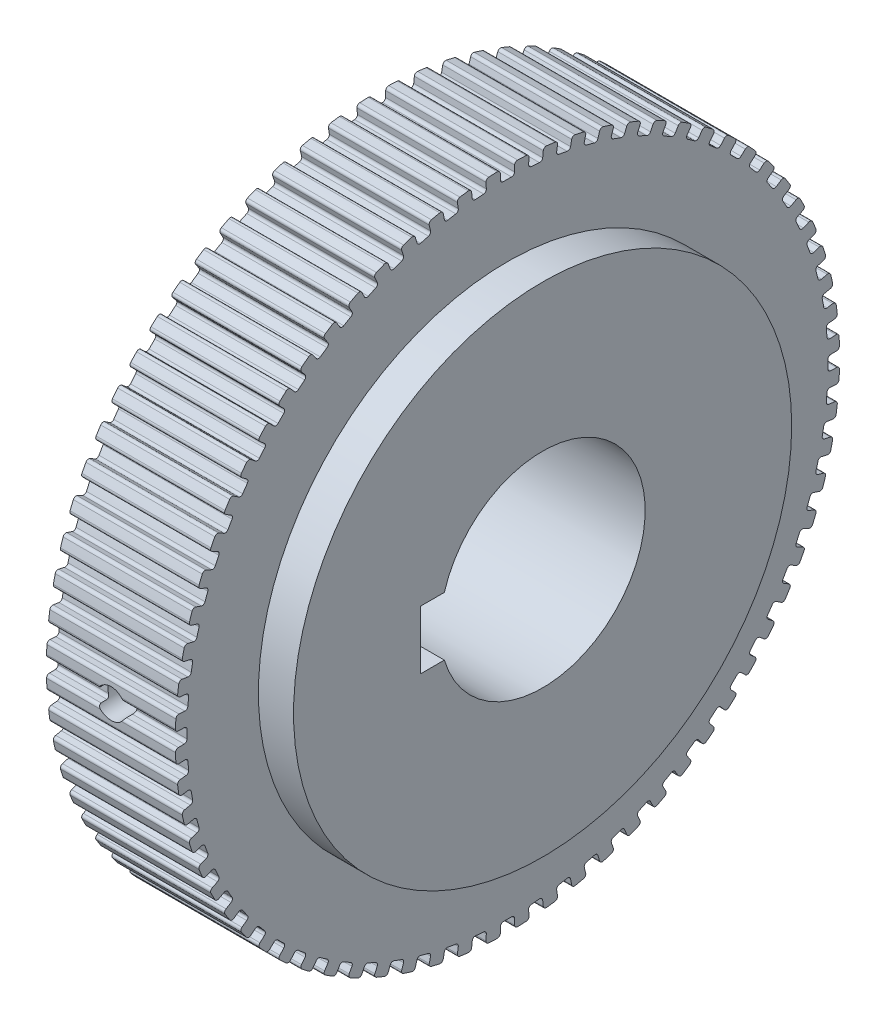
SolidWorks part; units mm, degrees
ref_plane "Спереди" through (0, 0, 0) normal (0, 0, 1) x (1, 0, 0)
ref_plane "Сверху" through (0, 0, 0) normal (0, 1, 0) x (1, 0, 0)
ref_plane "Справа" through (0, 0, 0) normal (1, 0, 0) x (0, 0, -1)
sketch "Эскиз1" plane through (0, 0, 0) normal (0, 0, 1) x (1, 0, 0)
  line L0 (-28, 56.675) -> (-28, 0)
  line L1 (-28, 0) -> (-6, 0)
  line L2 (-6, 0) -> (-6, 56.675)
  line L3 (-6, 56.675) -> (-28, 56.675)
  line L4 (-28, 0) -> (-6, 0) construction
revolve "Повернуть1" add sketch "Эскиз1" angle 360 about L4
sketch "Эскиз2" plane through (-6, 0, 0) normal (1, 0, 0) x (0, 0, -1)
  line L0 (56.0154, -8.6216) -> (54.0387, -8.3173)
  line L1 (53.6244, -10.6666) -> (55.586, -11.0567)
  arc A0 (54.0387, -8.3173) -> (53.6244, -10.6666) centre (0, 0) cw
  arc A1 (55.586, -11.0567) -> (56.0154, -8.6216) centre (0, 0) ccw
extrude "Вырез-Вытянуть1" cut sketch "Эскиз2" against normal through all
sketch "Эскиз3" plane through (-6, 0, 0) normal (1, 0, 0) x (0, 0, -1)
  line L0 (55.0508, -13.4708) -> (53.1081, -12.9955)
  line L1 (52.4907, -15.2997) -> (54.4108, -15.8593)
  arc A0 (53.1081, -12.9955) -> (52.4907, -15.2997) centre (0, 0) cw
  arc A1 (54.4108, -15.8593) -> (55.0508, -13.4708) centre (0, 0) ccw
extrude "Вырез-Вытянуть2" cut sketch "Эскиз3" against normal through all
sketch "Эскиз4" plane through (-6, 0, 0) normal (1, 0, 0) x (0, 0, -1)
  line L0 (53.6673, -18.2176) -> (51.7734, -17.5747)
  line L1 (50.9575, -19.8163) -> (52.8215, -20.5412)
  arc A0 (51.7734, -17.5747) -> (50.9575, -19.8163) centre (0, 0) cw
  arc A1 (52.8215, -20.5412) -> (53.6673, -18.2176) centre (0, 0) ccw
extrude "Вырез-Вытянуть3" cut sketch "Эскиз4" against normal through all
sketch "Эскиз5" plane through (-6, 0, 0) normal (1, 0, 0) x (0, 0, -1)
  line L0 (51.8753, -22.8257) -> (50.0447, -22.0202)
  line L1 (49.0365, -24.1821) -> (50.8303, -25.0667)
  arc A0 (50.0447, -22.0202) -> (49.0365, -24.1821) centre (0, 0) cw
  arc A1 (50.8303, -25.0667) -> (51.8753, -22.8257) centre (0, 0) ccw
extrude "Вырез-Вытянуть4" cut sketch "Эскиз5" against normal through all
sketch "Эскиз6" plane through (-6, 0, 0) normal (1, 0, 0) x (0, 0, -1)
  line L0 (49.6885, -27.26) -> (47.935, -26.2981)
  line L1 (46.7423, -28.3639) -> (48.4521, -29.4015)
  arc A0 (47.935, -26.2981) -> (46.7423, -28.3639) centre (0, 0) cw
  arc A1 (48.4521, -29.4015) -> (49.6885, -27.26) centre (0, 0) ccw
extrude "Вырез-Вытянуть5" cut sketch "Эскиз6" against normal through all
sketch "Эскиз7" plane through (-6, 0, 0) normal (1, 0, 0) x (0, 0, -1)
  line L0 (47.1235, -31.4869) -> (45.4606, -30.3758)
  line L1 (44.0924, -32.3299) -> (45.7052, -33.5125)
  arc A0 (45.4606, -30.3758) -> (44.0924, -32.3299) centre (0, 0) cw
  arc A1 (45.7052, -33.5125) -> (47.1235, -31.4869) centre (0, 0) ccw
extrude "Вырез-Вытянуть6" cut sketch "Эскиз7" against normal through all
sketch "Эскиз8" plane through (-6, 0, 0) normal (1, 0, 0) x (0, 0, -1)
  line L0 (44.2, -35.4742) -> (42.6402, -34.2224)
  line L1 (41.1068, -36.0497) -> (42.6105, -37.3684)
  arc A0 (42.6402, -34.2224) -> (41.1068, -36.0497) centre (0, 0) cw
  arc A1 (42.6105, -37.3684) -> (44.2, -35.4742) centre (0, 0) ccw
extrude "Вырез-Вытянуть7" cut sketch "Эскиз8" against normal through all
sketch "Эскиз9" plane through (-6, 0, 0) normal (1, 0, 0) x (0, 0, -1)
  line L0 (40.94, -39.1915) -> (39.4952, -37.8085)
  line L1 (37.8085, -39.4952) -> (39.1915, -40.94)
  arc A0 (39.4952, -37.8085) -> (37.8085, -39.4952) centre (0, 0) cw
  arc A1 (39.1915, -40.94) -> (40.94, -39.1915) centre (0, 0) ccw
extrude "Вырез-Вытянуть8" cut sketch "Эскиз9" against normal through all
sketch "Эскиз10" plane through (-6, 0, 0) normal (1, 0, 0) x (0, 0, -1)
  line L0 (37.3684, -42.6105) -> (36.0497, -41.1068)
  line L1 (34.2224, -42.6402) -> (35.4742, -44.2)
  arc A0 (36.0497, -41.1068) -> (34.2224, -42.6402) centre (0, 0) cw
  arc A1 (35.4742, -44.2) -> (37.3684, -42.6105) centre (0, 0) ccw
extrude "Вырез-Вытянуть9" cut sketch "Эскиз10" against normal through all
sketch "Эскиз11" plane through (-6, 0, 0) normal (1, 0, 0) x (0, 0, -1)
  line L0 (33.5125, -45.7052) -> (32.3299, -44.0924)
  line L1 (30.3758, -45.4606) -> (31.4869, -47.1235)
  arc A0 (32.3299, -44.0924) -> (30.3758, -45.4606) centre (0, 0) cw
  arc A1 (31.4869, -47.1235) -> (33.5125, -45.7052) centre (0, 0) ccw
extrude "Вырез-Вытянуть10" cut sketch "Эскиз11" against normal through all
sketch "Эскиз12" plane through (-6, 0, 0) normal (1, 0, 0) x (0, 0, -1)
  line L0 (29.4015, -48.4521) -> (28.3639, -46.7423)
  line L1 (26.2981, -47.935) -> (27.26, -49.6885)
  arc A0 (28.3639, -46.7423) -> (26.2981, -47.935) centre (0, 0) cw
  arc A1 (27.26, -49.6885) -> (29.4015, -48.4521) centre (0, 0) ccw
extrude "Вырез-Вытянуть11" cut sketch "Эскиз12" against normal through all
sketch "Эскиз13" plane through (-6, 0, 0) normal (1, 0, 0) x (0, 0, -1)
  line L0 (25.0667, -50.8303) -> (24.1821, -49.0365)
  line L1 (22.0202, -50.0447) -> (22.8257, -51.8753)
  arc A0 (24.1821, -49.0365) -> (22.0202, -50.0447) centre (0, 0) cw
  arc A1 (22.8257, -51.8753) -> (25.0667, -50.8303) centre (0, 0) ccw
extrude "Вырез-Вытянуть12" cut sketch "Эскиз13" against normal through all
sketch "Эскиз14" plane through (-6, 0, 0) normal (1, 0, 0) x (0, 0, -1)
  line L0 (20.5412, -52.8215) -> (19.8163, -50.9575)
  line L1 (17.5747, -51.7734) -> (18.2176, -53.6673)
  arc A0 (19.8163, -50.9575) -> (17.5747, -51.7734) centre (0, 0) cw
  arc A1 (18.2176, -53.6673) -> (20.5412, -52.8215) centre (0, 0) ccw
extrude "Вырез-Вытянуть13" cut sketch "Эскиз14" against normal through all
sketch "Эскиз15" plane through (-6, 0, 0) normal (1, 0, 0) x (0, 0, -1)
  line L0 (15.8593, -54.4108) -> (15.2997, -52.4907)
  line L1 (12.9955, -53.1081) -> (13.4708, -55.0508)
  arc A0 (15.2997, -52.4907) -> (12.9955, -53.1081) centre (0, 0) cw
  arc A1 (13.4708, -55.0508) -> (15.8593, -54.4108) centre (0, 0) ccw
extrude "Вырез-Вытянуть14" cut sketch "Эскиз15" against normal through all
sketch "Эскиз16" plane through (-6, 0, 0) normal (1, 0, 0) x (0, 0, -1)
  line L0 (11.0567, -55.586) -> (10.6666, -53.6244)
  line L1 (8.3173, -54.0387) -> (8.6216, -56.0154)
  arc A0 (10.6666, -53.6244) -> (8.3173, -54.0387) centre (0, 0) cw
  arc A1 (8.6216, -56.0154) -> (11.0567, -55.586) centre (0, 0) ccw
extrude "Вырез-Вытянуть15" cut sketch "Эскиз16" against normal through all
sketch "Эскиз17" plane through (-6, 0, 0) normal (1, 0, 0) x (0, 0, -1)
  line L0 (6.17, -56.3381) -> (5.9523, -54.35)
  line L1 (3.5759, -54.5579) -> (3.7067, -56.5537)
  arc A0 (5.9523, -54.35) -> (3.5759, -54.5579) centre (0, 0) cw
  arc A1 (3.7067, -56.5537) -> (6.17, -56.3381) centre (0, 0) ccw
extrude "Вырез-Вытянуть16" cut sketch "Эскиз17" against normal through all
sketch "Эскиз18" plane through (-6, 0, 0) normal (1, 0, 0) x (0, 0, -1)
  line L0 (1.2364, -56.6615) -> (1.1927, -54.662)
  line L1 (-1.1927, -54.662) -> (-1.2364, -56.6615)
  arc A0 (1.1927, -54.662) -> (-1.1927, -54.662) centre (0, 0) cw
  arc A1 (-1.2364, -56.6615) -> (1.2364, -56.6615) centre (0, 0) ccw
extrude "Вырез-Вытянуть17" cut sketch "Эскиз18" against normal through all
sketch "Эскиз19" plane through (-6, 0, 0) normal (1, 0, 0) x (0, 0, -1)
  line L0 (-3.7067, -56.5537) -> (-3.5759, -54.5579)
  line L1 (-5.9523, -54.35) -> (-6.17, -56.3381)
  arc A0 (-3.5759, -54.5579) -> (-5.9523, -54.35) centre (0, 0) cw
  arc A1 (-6.17, -56.3381) -> (-3.7067, -56.5537) centre (0, 0) ccw
extrude "Вырез-Вытянуть18" cut sketch "Эскиз19" against normal through all
sketch "Эскиз20" plane through (-6, 0, 0) normal (1, 0, 0) x (0, 0, -1)
  line L0 (-8.6216, -56.0154) -> (-8.3173, -54.0387)
  line L1 (-10.6666, -53.6244) -> (-11.0567, -55.586)
  arc A0 (-8.3173, -54.0387) -> (-10.6666, -53.6244) centre (0, 0) cw
  arc A1 (-11.0567, -55.586) -> (-8.6216, -56.0154) centre (0, 0) ccw
extrude "Вырез-Вытянуть19" cut sketch "Эскиз20" against normal through all
sketch "Эскиз21" plane through (-6, 0, 0) normal (1, 0, 0) x (0, 0, -1)
  line L0 (-13.4708, -55.0508) -> (-12.9955, -53.1081)
  line L1 (-15.2997, -52.4907) -> (-15.8593, -54.4108)
  arc A0 (-12.9955, -53.1081) -> (-15.2997, -52.4907) centre (0, 0) cw
  arc A1 (-15.8593, -54.4108) -> (-13.4708, -55.0508) centre (0, 0) ccw
extrude "Вырез-Вытянуть20" cut sketch "Эскиз21" against normal through all
sketch "Эскиз22" plane through (-6, 0, 0) normal (1, 0, 0) x (0, 0, -1)
  line L0 (-18.2176, -53.6673) -> (-17.5747, -51.7734)
  line L1 (-19.8163, -50.9575) -> (-20.5412, -52.8215)
  arc A0 (-17.5747, -51.7734) -> (-19.8163, -50.9575) centre (0, 0) cw
  arc A1 (-20.5412, -52.8215) -> (-18.2176, -53.6673) centre (0, 0) ccw
extrude "Вырез-Вытянуть21" cut sketch "Эскиз22" against normal through all
sketch "Эскиз23" plane through (-6, 0, 0) normal (1, 0, 0) x (0, 0, -1)
  line L0 (-22.8257, -51.8753) -> (-22.0202, -50.0447)
  line L1 (-24.1821, -49.0365) -> (-25.0667, -50.8303)
  arc A0 (-22.0202, -50.0447) -> (-24.1821, -49.0365) centre (0, 0) cw
  arc A1 (-25.0667, -50.8303) -> (-22.8257, -51.8753) centre (0, 0) ccw
extrude "Вырез-Вытянуть22" cut sketch "Эскиз23" against normal through all
sketch "Эскиз24" plane through (-6, 0, 0) normal (1, 0, 0) x (0, 0, -1)
  line L0 (-27.26, -49.6885) -> (-26.2981, -47.935)
  line L1 (-28.3639, -46.7423) -> (-29.4015, -48.4521)
  arc A0 (-26.2981, -47.935) -> (-28.3639, -46.7423) centre (0, 0) cw
  arc A1 (-29.4015, -48.4521) -> (-27.26, -49.6885) centre (0, 0) ccw
extrude "Вырез-Вытянуть23" cut sketch "Эскиз24" against normal through all
sketch "Эскиз25" plane through (-6, 0, 0) normal (1, 0, 0) x (0, 0, -1)
  line L0 (-31.4869, -47.1235) -> (-30.3758, -45.4606)
  line L1 (-32.3299, -44.0924) -> (-33.5125, -45.7052)
  arc A0 (-30.3758, -45.4606) -> (-32.3299, -44.0924) centre (0, 0) cw
  arc A1 (-33.5125, -45.7052) -> (-31.4869, -47.1235) centre (0, 0) ccw
extrude "Вырез-Вытянуть24" cut sketch "Эскиз25" against normal through all
sketch "Эскиз26" plane through (-6, 0, 0) normal (1, 0, 0) x (0, 0, -1)
  line L0 (-35.4742, -44.2) -> (-34.2224, -42.6402)
  line L1 (-36.0497, -41.1068) -> (-37.3684, -42.6105)
  arc A0 (-34.2224, -42.6402) -> (-36.0497, -41.1068) centre (0, 0) cw
  arc A1 (-37.3684, -42.6105) -> (-35.4742, -44.2) centre (0, 0) ccw
extrude "Вырез-Вытянуть25" cut sketch "Эскиз26" against normal through all
sketch "Эскиз27" plane through (-6, 0, 0) normal (1, 0, 0) x (0, 0, -1)
  line L0 (-39.1915, -40.94) -> (-37.8085, -39.4952)
  line L1 (-39.4952, -37.8085) -> (-40.94, -39.1915)
  arc A0 (-37.8085, -39.4952) -> (-39.4952, -37.8085) centre (0, 0) cw
  arc A1 (-40.94, -39.1915) -> (-39.1915, -40.94) centre (0, 0) ccw
extrude "Вырез-Вытянуть26" cut sketch "Эскиз27" against normal through all
sketch "Эскиз28" plane through (-6, 0, 0) normal (1, 0, 0) x (0, 0, -1)
  line L0 (-42.6105, -37.3684) -> (-41.1068, -36.0497)
  line L1 (-42.6402, -34.2224) -> (-44.2, -35.4742)
  arc A0 (-41.1068, -36.0497) -> (-42.6402, -34.2224) centre (0, 0) cw
  arc A1 (-44.2, -35.4742) -> (-42.6105, -37.3684) centre (0, 0) ccw
extrude "Вырез-Вытянуть27" cut sketch "Эскиз28" against normal through all
sketch "Эскиз29" plane through (-6, 0, 0) normal (1, 0, 0) x (0, 0, -1)
  line L0 (-45.7052, -33.5125) -> (-44.0924, -32.3299)
  line L1 (-45.4606, -30.3758) -> (-47.1235, -31.4869)
  arc A0 (-44.0924, -32.3299) -> (-45.4606, -30.3758) centre (0, 0) cw
  arc A1 (-47.1235, -31.4869) -> (-45.7052, -33.5125) centre (0, 0) ccw
extrude "Вырез-Вытянуть28" cut sketch "Эскиз29" against normal through all
sketch "Эскиз30" plane through (-6, 0, 0) normal (1, 0, 0) x (0, 0, -1)
  line L0 (-48.4521, -29.4015) -> (-46.7423, -28.3639)
  line L1 (-47.935, -26.2981) -> (-49.6885, -27.26)
  arc A0 (-46.7423, -28.3639) -> (-47.935, -26.2981) centre (0, 0) cw
  arc A1 (-49.6885, -27.26) -> (-48.4521, -29.4015) centre (0, 0) ccw
extrude "Вырез-Вытянуть29" cut sketch "Эскиз30" against normal through all
sketch "Эскиз31" plane through (-6, 0, 0) normal (1, 0, 0) x (0, 0, -1)
  line L0 (-50.8303, -25.0667) -> (-49.0365, -24.1821)
  line L1 (-50.0447, -22.0202) -> (-51.8753, -22.8257)
  arc A0 (-49.0365, -24.1821) -> (-50.0447, -22.0202) centre (0, 0) cw
  arc A1 (-51.8753, -22.8257) -> (-50.8303, -25.0667) centre (0, 0) ccw
extrude "Вырез-Вытянуть30" cut sketch "Эскиз31" against normal through all
sketch "Эскиз32" plane through (-6, 0, 0) normal (1, 0, 0) x (0, 0, -1)
  line L0 (-52.8215, -20.5412) -> (-50.9575, -19.8163)
  line L1 (-51.7734, -17.5747) -> (-53.6673, -18.2176)
  arc A0 (-50.9575, -19.8163) -> (-51.7734, -17.5747) centre (0, 0) cw
  arc A1 (-53.6673, -18.2176) -> (-52.8215, -20.5412) centre (0, 0) ccw
extrude "Вырез-Вытянуть31" cut sketch "Эскиз32" against normal through all
sketch "Эскиз33" plane through (-6, 0, 0) normal (1, 0, 0) x (0, 0, -1)
  line L0 (-54.4108, -15.8593) -> (-52.4907, -15.2997)
  line L1 (-53.1081, -12.9955) -> (-55.0508, -13.4708)
  arc A0 (-52.4907, -15.2997) -> (-53.1081, -12.9955) centre (0, 0) cw
  arc A1 (-55.0508, -13.4708) -> (-54.4108, -15.8593) centre (0, 0) ccw
extrude "Вырез-Вытянуть32" cut sketch "Эскиз33" against normal through all
sketch "Эскиз34" plane through (-6, 0, 0) normal (1, 0, 0) x (0, 0, -1)
  line L0 (-55.586, -11.0567) -> (-53.6244, -10.6666)
  line L1 (-54.0387, -8.3173) -> (-56.0154, -8.6216)
  arc A0 (-53.6244, -10.6666) -> (-54.0387, -8.3173) centre (0, 0) cw
  arc A1 (-56.0154, -8.6216) -> (-55.586, -11.0567) centre (0, 0) ccw
extrude "Вырез-Вытянуть33" cut sketch "Эскиз34" against normal through all
sketch "Эскиз35" plane through (-6, 0, 0) normal (1, 0, 0) x (0, 0, -1)
  line L0 (-56.3381, -6.17) -> (-54.35, -5.9523)
  line L1 (-54.5579, -3.5759) -> (-56.5537, -3.7067)
  arc A0 (-54.35, -5.9523) -> (-54.5579, -3.5759) centre (0, 0) cw
  arc A1 (-56.5537, -3.7067) -> (-56.3381, -6.17) centre (0, 0) ccw
extrude "Вырез-Вытянуть34" cut sketch "Эскиз35" against normal through all
sketch "Эскиз36" plane through (-6, 0, 0) normal (1, 0, 0) x (0, 0, -1)
  line L0 (-56.6615, -1.2364) -> (-54.662, -1.1927)
  line L1 (-54.662, 1.1927) -> (-56.6615, 1.2364)
  arc A0 (-56.6615, 1.2364) -> (-56.6615, -1.2364) centre (0, 0) ccw
  arc A1 (-54.662, -1.1927) -> (-54.662, 1.1927) centre (0, 0) cw
extrude "Вырез-Вытянуть35" cut sketch "Эскиз36" against normal through all
sketch "Эскиз37" plane through (-6, 0, 0) normal (1, 0, 0) x (0, 0, -1)
  line L0 (-56.5537, 3.7067) -> (-54.5579, 3.5759)
  line L1 (-54.35, 5.9523) -> (-56.3381, 6.17)
  arc A0 (-54.5579, 3.5759) -> (-54.35, 5.9523) centre (0, 0) cw
  arc A1 (-56.3381, 6.17) -> (-56.5537, 3.7067) centre (0, 0) ccw
extrude "Вырез-Вытянуть36" cut sketch "Эскиз37" against normal through all
sketch "Эскиз38" plane through (-6, 0, 0) normal (1, 0, 0) x (0, 0, -1)
  line L0 (-56.0154, 8.6216) -> (-54.0387, 8.3173)
  line L1 (-53.6244, 10.6666) -> (-55.586, 11.0567)
  arc A0 (-54.0387, 8.3173) -> (-53.6244, 10.6666) centre (0, 0) cw
  arc A1 (-55.586, 11.0567) -> (-56.0154, 8.6216) centre (0, 0) ccw
extrude "Вырез-Вытянуть37" cut sketch "Эскиз38" against normal through all
sketch "Эскиз39" plane through (-6, 0, 0) normal (1, 0, 0) x (0, 0, -1)
  line L0 (-55.0508, 13.4708) -> (-53.1081, 12.9955)
  line L1 (-52.4907, 15.2997) -> (-54.4108, 15.8593)
  arc A0 (-53.1081, 12.9955) -> (-52.4907, 15.2997) centre (0, 0) cw
  arc A1 (-54.4108, 15.8593) -> (-55.0508, 13.4708) centre (0, 0) ccw
extrude "Вырез-Вытянуть38" cut sketch "Эскиз39" against normal through all
sketch "Эскиз40" plane through (-6, 0, 0) normal (1, 0, 0) x (0, 0, -1)
  line L0 (-53.6673, 18.2176) -> (-51.7734, 17.5747)
  line L1 (-50.9575, 19.8163) -> (-52.8215, 20.5412)
  arc A0 (-51.7734, 17.5747) -> (-50.9575, 19.8163) centre (0, 0) cw
  arc A1 (-52.8215, 20.5412) -> (-53.6673, 18.2176) centre (0, 0) ccw
extrude "Вырез-Вытянуть39" cut sketch "Эскиз40" against normal through all
sketch "Эскиз41" plane through (-6, 0, 0) normal (1, 0, 0) x (0, 0, -1)
  line L0 (-51.8753, 22.8257) -> (-50.0447, 22.0202)
  line L1 (-49.0365, 24.1821) -> (-50.8303, 25.0667)
  arc A0 (-50.0447, 22.0202) -> (-49.0365, 24.1821) centre (0, 0) cw
  arc A1 (-50.8303, 25.0667) -> (-51.8753, 22.8257) centre (0, 0) ccw
extrude "Вырез-Вытянуть40" cut sketch "Эскиз41" against normal through all
sketch "Эскиз42" plane through (-6, 0, 0) normal (1, 0, 0) x (0, 0, -1)
  line L0 (-49.6885, 27.26) -> (-47.935, 26.2981)
  line L1 (-46.7423, 28.3639) -> (-48.4521, 29.4015)
  arc A0 (-47.935, 26.2981) -> (-46.7423, 28.3639) centre (0, 0) cw
  arc A1 (-48.4521, 29.4015) -> (-49.6885, 27.26) centre (0, 0) ccw
extrude "Вырез-Вытянуть41" cut sketch "Эскиз42" against normal through all
sketch "Эскиз43" plane through (-6, 0, 0) normal (1, 0, 0) x (0, 0, -1)
  line L0 (-47.1235, 31.4869) -> (-45.4606, 30.3758)
  line L1 (-44.0924, 32.3299) -> (-45.7052, 33.5125)
  arc A0 (-45.4606, 30.3758) -> (-44.0924, 32.3299) centre (0, 0) cw
  arc A1 (-45.7052, 33.5125) -> (-47.1235, 31.4869) centre (0, 0) ccw
extrude "Вырез-Вытянуть42" cut sketch "Эскиз43" against normal through all
sketch "Эскиз44" plane through (-6, 0, 0) normal (1, 0, 0) x (0, 0, -1)
  line L0 (-44.2, 35.4742) -> (-42.6402, 34.2224)
  line L1 (-41.1068, 36.0497) -> (-42.6105, 37.3684)
  arc A0 (-42.6402, 34.2224) -> (-41.1068, 36.0497) centre (0, 0) cw
  arc A1 (-42.6105, 37.3684) -> (-44.2, 35.4742) centre (0, 0) ccw
extrude "Вырез-Вытянуть43" cut sketch "Эскиз44" against normal through all
sketch "Эскиз45" plane through (-6, 0, 0) normal (1, 0, 0) x (0, 0, -1)
  line L0 (-40.94, 39.1915) -> (-39.4952, 37.8085)
  line L1 (-37.8085, 39.4952) -> (-39.1915, 40.94)
  arc A0 (-39.4952, 37.8085) -> (-37.8085, 39.4952) centre (0, 0) cw
  arc A1 (-39.1915, 40.94) -> (-40.94, 39.1915) centre (0, 0) ccw
extrude "Вырез-Вытянуть44" cut sketch "Эскиз45" against normal through all
sketch "Эскиз46" plane through (-6, 0, 0) normal (1, 0, 0) x (0, 0, -1)
  line L0 (-37.3684, 42.6105) -> (-36.0497, 41.1068)
  line L1 (-34.2224, 42.6402) -> (-35.4742, 44.2)
  arc A0 (-36.0497, 41.1068) -> (-34.2224, 42.6402) centre (0, 0) cw
  arc A1 (-35.4742, 44.2) -> (-37.3684, 42.6105) centre (0, 0) ccw
extrude "Вырез-Вытянуть45" cut sketch "Эскиз46" against normal through all
sketch "Эскиз47" plane through (-6, 0, 0) normal (1, 0, 0) x (0, 0, -1)
  line L0 (-33.5125, 45.7052) -> (-32.3299, 44.0924)
  line L1 (-30.3758, 45.4606) -> (-31.4869, 47.1235)
  arc A0 (-32.3299, 44.0924) -> (-30.3758, 45.4606) centre (0, 0) cw
  arc A1 (-31.4869, 47.1235) -> (-33.5125, 45.7052) centre (0, 0) ccw
extrude "Вырез-Вытянуть46" cut sketch "Эскиз47" against normal through all
sketch "Эскиз48" plane through (-6, 0, 0) normal (1, 0, 0) x (0, 0, -1)
  line L0 (-29.4015, 48.4521) -> (-28.3639, 46.7423)
  line L1 (-26.2981, 47.935) -> (-27.26, 49.6885)
  arc A0 (-28.3639, 46.7423) -> (-26.2981, 47.935) centre (0, 0) cw
  arc A1 (-27.26, 49.6885) -> (-29.4015, 48.4521) centre (0, 0) ccw
extrude "Вырез-Вытянуть47" cut sketch "Эскиз48" against normal through all
sketch "Эскиз49" plane through (-6, 0, 0) normal (1, 0, 0) x (0, 0, -1)
  line L0 (-25.0667, 50.8303) -> (-24.1821, 49.0365)
  line L1 (-22.0202, 50.0447) -> (-22.8257, 51.8753)
  arc A0 (-24.1821, 49.0365) -> (-22.0202, 50.0447) centre (0, 0) cw
  arc A1 (-22.8257, 51.8753) -> (-25.0667, 50.8303) centre (0, 0) ccw
extrude "Вырез-Вытянуть48" cut sketch "Эскиз49" against normal through all
sketch "Эскиз50" plane through (-6, 0, 0) normal (1, 0, 0) x (0, 0, -1)
  line L0 (-20.5412, 52.8215) -> (-19.8163, 50.9575)
  line L1 (-17.5747, 51.7734) -> (-18.2176, 53.6673)
  arc A0 (-19.8163, 50.9575) -> (-17.5747, 51.7734) centre (0, 0) cw
  arc A1 (-18.2176, 53.6673) -> (-20.5412, 52.8215) centre (0, 0) ccw
extrude "Вырез-Вытянуть49" cut sketch "Эскиз50" against normal through all
sketch "Эскиз51" plane through (-6, 0, 0) normal (1, 0, 0) x (0, 0, -1)
  line L0 (-15.8593, 54.4108) -> (-15.2997, 52.4907)
  line L1 (-12.9955, 53.1081) -> (-13.4708, 55.0508)
  arc A0 (-15.2997, 52.4907) -> (-12.9955, 53.1081) centre (0, 0) cw
  arc A1 (-13.4708, 55.0508) -> (-15.8593, 54.4108) centre (0, 0) ccw
extrude "Вырез-Вытянуть50" cut sketch "Эскиз51" against normal through all
sketch "Эскиз52" plane through (-6, 0, 0) normal (1, 0, 0) x (0, 0, -1)
  line L0 (-11.0567, 55.586) -> (-10.6666, 53.6244)
  line L1 (-8.3173, 54.0387) -> (-8.6216, 56.0154)
  arc A0 (-10.6666, 53.6244) -> (-8.3173, 54.0387) centre (0, 0) cw
  arc A1 (-8.6216, 56.0154) -> (-11.0567, 55.586) centre (0, 0) ccw
extrude "Вырез-Вытянуть51" cut sketch "Эскиз52" against normal through all
sketch "Эскиз53" plane through (-6, 0, 0) normal (1, 0, 0) x (0, 0, -1)
  line L0 (-6.17, 56.3381) -> (-5.9523, 54.35)
  line L1 (-3.5759, 54.5579) -> (-3.7067, 56.5537)
  arc A0 (-5.9523, 54.35) -> (-3.5759, 54.5579) centre (0, 0) cw
  arc A1 (-3.7067, 56.5537) -> (-6.17, 56.3381) centre (0, 0) ccw
extrude "Вырез-Вытянуть52" cut sketch "Эскиз53" against normal through all
sketch "Эскиз54" plane through (-6, 0, 0) normal (1, 0, 0) x (0, 0, -1)
  line L0 (-1.2364, 56.6615) -> (-1.1927, 54.662)
  line L1 (1.1927, 54.662) -> (1.2364, 56.6615)
  arc A0 (-1.1927, 54.662) -> (1.1927, 54.662) centre (0, 0) cw
  arc A1 (1.2364, 56.6615) -> (-1.2364, 56.6615) centre (0, 0) ccw
extrude "Вырез-Вытянуть53" cut sketch "Эскиз54" against normal through all
sketch "Эскиз55" plane through (-6, 0, 0) normal (1, 0, 0) x (0, 0, -1)
  line L0 (3.7067, 56.5537) -> (3.5759, 54.5579)
  line L1 (5.9523, 54.35) -> (6.17, 56.3381)
  arc A0 (3.5759, 54.5579) -> (5.9523, 54.35) centre (0, 0) cw
  arc A1 (6.17, 56.3381) -> (3.7067, 56.5537) centre (0, 0) ccw
extrude "Вырез-Вытянуть54" cut sketch "Эскиз55" against normal through all
sketch "Эскиз56" plane through (-6, 0, 0) normal (1, 0, 0) x (0, 0, -1)
  line L0 (8.6216, 56.0154) -> (8.3173, 54.0387)
  line L1 (10.6666, 53.6244) -> (11.0567, 55.586)
  arc A0 (8.3173, 54.0387) -> (10.6666, 53.6244) centre (0, 0) cw
  arc A1 (11.0567, 55.586) -> (8.6216, 56.0154) centre (0, 0) ccw
extrude "Вырез-Вытянуть55" cut sketch "Эскиз56" against normal through all
sketch "Эскиз57" plane through (-6, 0, 0) normal (1, 0, 0) x (0, 0, -1)
  line L0 (13.4708, 55.0508) -> (12.9955, 53.1081)
  line L1 (15.2997, 52.4907) -> (15.8593, 54.4108)
  arc A0 (12.9955, 53.1081) -> (15.2997, 52.4907) centre (0, 0) cw
  arc A1 (15.8593, 54.4108) -> (13.4708, 55.0508) centre (0, 0) ccw
extrude "Вырез-Вытянуть56" cut sketch "Эскиз57" against normal through all
sketch "Эскиз58" plane through (-6, 0, 0) normal (1, 0, 0) x (0, 0, -1)
  line L0 (18.2176, 53.6673) -> (17.5747, 51.7734)
  line L1 (19.8163, 50.9575) -> (20.5412, 52.8215)
  arc A0 (17.5747, 51.7734) -> (19.8163, 50.9575) centre (0, 0) cw
  arc A1 (20.5412, 52.8215) -> (18.2176, 53.6673) centre (0, 0) ccw
extrude "Вырез-Вытянуть57" cut sketch "Эскиз58" against normal through all
sketch "Эскиз59" plane through (-6, 0, 0) normal (1, 0, 0) x (0, 0, -1)
  line L0 (22.8257, 51.8753) -> (22.0202, 50.0447)
  line L1 (24.1821, 49.0365) -> (25.0667, 50.8303)
  arc A0 (22.0202, 50.0447) -> (24.1821, 49.0365) centre (0, 0) cw
  arc A1 (25.0667, 50.8303) -> (22.8257, 51.8753) centre (0, 0) ccw
extrude "Вырез-Вытянуть58" cut sketch "Эскиз59" against normal through all
sketch "Эскиз60" plane through (-6, 0, 0) normal (1, 0, 0) x (0, 0, -1)
  line L0 (27.26, 49.6885) -> (26.2981, 47.935)
  line L1 (28.3639, 46.7423) -> (29.4015, 48.4521)
  arc A0 (26.2981, 47.935) -> (28.3639, 46.7423) centre (0, 0) cw
  arc A1 (29.4015, 48.4521) -> (27.26, 49.6885) centre (0, 0) ccw
extrude "Вырез-Вытянуть59" cut sketch "Эскиз60" against normal through all
sketch "Эскиз61" plane through (-6, 0, 0) normal (1, 0, 0) x (0, 0, -1)
  line L0 (31.4869, 47.1235) -> (30.3758, 45.4606)
  line L1 (32.3299, 44.0924) -> (33.5125, 45.7052)
  arc A0 (30.3758, 45.4606) -> (32.3299, 44.0924) centre (0, 0) cw
  arc A1 (33.5125, 45.7052) -> (31.4869, 47.1235) centre (0, 0) ccw
extrude "Вырез-Вытянуть60" cut sketch "Эскиз61" against normal through all
sketch "Эскиз62" plane through (-6, 0, 0) normal (1, 0, 0) x (0, 0, -1)
  line L0 (35.4742, 44.2) -> (34.2224, 42.6402)
  line L1 (36.0497, 41.1068) -> (37.3684, 42.6105)
  arc A0 (34.2224, 42.6402) -> (36.0497, 41.1068) centre (0, 0) cw
  arc A1 (37.3684, 42.6105) -> (35.4742, 44.2) centre (0, 0) ccw
extrude "Вырез-Вытянуть61" cut sketch "Эскиз62" against normal through all
sketch "Эскиз63" plane through (-6, 0, 0) normal (1, 0, 0) x (0, 0, -1)
  line L0 (39.1915, 40.94) -> (37.8085, 39.4952)
  line L1 (39.4952, 37.8085) -> (40.94, 39.1915)
  arc A0 (37.8085, 39.4952) -> (39.4952, 37.8085) centre (0, 0) cw
  arc A1 (40.94, 39.1915) -> (39.1915, 40.94) centre (0, 0) ccw
extrude "Вырез-Вытянуть62" cut sketch "Эскиз63" against normal through all
sketch "Эскиз64" plane through (-6, 0, 0) normal (1, 0, 0) x (0, 0, -1)
  line L0 (42.6105, 37.3684) -> (41.1068, 36.0497)
  line L1 (42.6402, 34.2224) -> (44.2, 35.4742)
  arc A0 (41.1068, 36.0497) -> (42.6402, 34.2224) centre (0, 0) cw
  arc A1 (44.2, 35.4742) -> (42.6105, 37.3684) centre (0, 0) ccw
extrude "Вырез-Вытянуть63" cut sketch "Эскиз64" against normal through all
sketch "Эскиз65" plane through (-6, 0, 0) normal (1, 0, 0) x (0, 0, -1)
  line L0 (45.7052, 33.5125) -> (44.0924, 32.3299)
  line L1 (45.4606, 30.3758) -> (47.1235, 31.4869)
  arc A0 (44.0924, 32.3299) -> (45.4606, 30.3758) centre (0, 0) cw
  arc A1 (47.1235, 31.4869) -> (45.7052, 33.5125) centre (0, 0) ccw
extrude "Вырез-Вытянуть64" cut sketch "Эскиз65" against normal through all
sketch "Эскиз66" plane through (-6, 0, 0) normal (1, 0, 0) x (0, 0, -1)
  line L0 (48.4521, 29.4015) -> (46.7423, 28.3639)
  line L1 (47.935, 26.2981) -> (49.6885, 27.26)
  arc A0 (46.7423, 28.3639) -> (47.935, 26.2981) centre (0, 0) cw
  arc A1 (49.6885, 27.26) -> (48.4521, 29.4015) centre (0, 0) ccw
extrude "Вырез-Вытянуть65" cut sketch "Эскиз66" against normal through all
sketch "Эскиз67" plane through (-6, 0, 0) normal (1, 0, 0) x (0, 0, -1)
  line L0 (50.8303, 25.0667) -> (49.0365, 24.1821)
  line L1 (50.0447, 22.0202) -> (51.8753, 22.8257)
  arc A0 (49.0365, 24.1821) -> (50.0447, 22.0202) centre (0, 0) cw
  arc A1 (51.8753, 22.8257) -> (50.8303, 25.0667) centre (0, 0) ccw
extrude "Вырез-Вытянуть66" cut sketch "Эскиз67" against normal through all
sketch "Эскиз68" plane through (-6, 0, 0) normal (1, 0, 0) x (0, 0, -1)
  line L0 (52.8215, 20.5412) -> (50.9575, 19.8163)
  line L1 (51.7734, 17.5747) -> (53.6673, 18.2176)
  arc A0 (50.9575, 19.8163) -> (51.7734, 17.5747) centre (0, 0) cw
  arc A1 (53.6673, 18.2176) -> (52.8215, 20.5412) centre (0, 0) ccw
extrude "Вырез-Вытянуть67" cut sketch "Эскиз68" against normal through all
sketch "Эскиз69" plane through (-6, 0, 0) normal (1, 0, 0) x (0, 0, -1)
  line L0 (54.4108, 15.8593) -> (52.4907, 15.2997)
  line L1 (53.1081, 12.9955) -> (55.0508, 13.4708)
  arc A0 (52.4907, 15.2997) -> (53.1081, 12.9955) centre (0, 0) cw
  arc A1 (55.0508, 13.4708) -> (54.4108, 15.8593) centre (0, 0) ccw
extrude "Вырез-Вытянуть68" cut sketch "Эскиз69" against normal through all
sketch "Эскиз70" plane through (-6, 0, 0) normal (1, 0, 0) x (0, 0, -1)
  line L0 (55.586, 11.0567) -> (53.6244, 10.6666)
  line L1 (54.0387, 8.3173) -> (56.0154, 8.6216)
  arc A0 (53.6244, 10.6666) -> (54.0387, 8.3173) centre (0, 0) cw
  arc A1 (56.0154, 8.6216) -> (55.586, 11.0567) centre (0, 0) ccw
extrude "Вырез-Вытянуть69" cut sketch "Эскиз70" against normal through all
sketch "Эскиз71" plane through (-6, 0, 0) normal (1, 0, 0) x (0, 0, -1)
  line L0 (56.3381, 6.17) -> (54.35, 5.9523)
  line L1 (54.5579, 3.5759) -> (56.5537, 3.7067)
  arc A0 (54.35, 5.9523) -> (54.5579, 3.5759) centre (0, 0) cw
  arc A1 (56.5537, 3.7067) -> (56.3381, 6.17) centre (0, 0) ccw
extrude "Вырез-Вытянуть70" cut sketch "Эскиз71" against normal through all
sketch "Эскиз72" plane through (-6, 0, 0) normal (1, 0, 0) x (0, 0, -1)
  line L0 (56.6615, 1.2364) -> (54.662, 1.1927)
  line L1 (54.662, -1.1927) -> (56.6615, -1.2364)
  arc A0 (54.662, 1.1927) -> (54.662, -1.1927) centre (0, 0) cw
  arc A1 (56.6615, -1.2364) -> (56.6615, 1.2364) centre (0, 0) ccw
extrude "Вырез-Вытянуть71" cut sketch "Эскиз72" against normal through all
sketch "Эскиз73" plane through (-6, 0, 0) normal (1, 0, 0) x (0, 0, -1)
  line L0 (56.5537, -3.7067) -> (54.5579, -3.5759)
  line L1 (54.35, -5.9523) -> (56.3381, -6.17)
  arc A0 (54.5579, -3.5759) -> (54.35, -5.9523) centre (0, 0) cw
  arc A1 (56.3381, -6.17) -> (56.5537, -3.7067) centre (0, 0) ccw
extrude "Вырез-Вытянуть72" cut sketch "Эскиз73" against normal through all
sketch "Эскиз74" plane through (-6, 0, 0) normal (1, 0, 0) x (0, 0, -1)
  circle A0 centre (0, 0) radius 42.5
extrude "Бобышка-Вытянуть1" add sketch "Эскиз74" along normal blind 6
sketch "Эскиз75" plane through (0, 0, 0) normal (1, 0, 0) x (0, 0, -1)
  line L0 (-16.7705, 5) -> (-20.8, 5)
  line L1 (-20.8, 5) -> (-20.8, -5)
  line L2 (-20.8, -5) -> (-16.7705, -5)
  arc A0 (-16.7705, -5) -> (-16.7705, 5) centre (0, 0) cw
extrude "Вырез-Вытянуть73" cut sketch "Эскиз75" against normal through all
ref_plane "Плоскость4" through (0, 0, 0) normal (0, 0, -1) x (-1, 0, 0)
sketch "Эскиз76" plane through (0, 0, 0) normal (0, 0, -1) x (-1, 0, 0)
  line L0 (0, 17.5) -> (0, 0)
  line L1 (0, 0) -> (28, 0)
  line L2 (28, 0) -> (28, 17.5)
  line L3 (28, 17.5) -> (0, 17.5)
  line L4 (0, 0) -> (28, 0) construction
revolve "Вырез-Повернуть1" cut sketch "Эскиз76" angle 360 about L4
sketch "Эскиз77" plane through (0, 0, 0) normal (0, 1, 0) x (1, 0, 0)
  line L0 (-15, -20.8) -> (-17, -20.8)
  line L1 (-17, -20.8) -> (-17, -56.6615)
  line L2 (-17, -56.6615) -> (-14.5, -56.6615)
  line L3 (-14.5, -56.6615) -> (-14.5, -33.675)
  line L4 (-14.5, -33.675) -> (-15, -33.675)
  line L5 (-15, -33.675) -> (-15, -20.8)
  line L6 (-17, -20.8) -> (-17, -56.6615) construction
revolve "Вырез-Повернуть2" cut sketch "Эскиз77" angle 360 about L6
fillet "Скругление1" radius 0.5 54 edges at (-17, 25.0667, -50.8303) (-17, 15.8593, -54.4108) (-17, 56.5537, -3.7067) (-17, -1.1927, -54.662) (-17, 29.4015, -48.4521) (-17, 20.5412, -52.8215) (-17, 56.6615, 1.2364) (-17, 56.5537, 3.7067) (-17, 22.0202, -50.0447) (-17, 8.3173, -54.0387) (-17, 36.0497, -41.1068) (-17, -56.6615, -1.2364) (-17, 8.6216, -56.0154) (-17, 5.9523, -54.35) (-17, 53.6244, 10.6666) (-17, -56.3381, -6.17) (-17, -3.7067, -56.5537) (-17, 55.586, 11.0567) (-17, -56.0154, -8.6216) (-17, -34.2224, 42.6402) (-17, -55.0508, 13.4708) (-17, -31.4869, 47.1235) (-17, -53.1081, 12.9955) (-17, -24.1821, 49.0365) (-17, -22.8257, 51.8753) (-17, -17.5747, 51.7734) (-17, -13.4708, 55.0508) (-23.5986, -1.1927, 54.662) (-23.5864, -1.2364, 56.6615) (-17, -1.2364, -56.6615) (-17, -42.6105, -37.3684) (-17, -40.94, -39.1915) (-17, 36.0497, 41.1068) (-17, 34.2224, 42.6402) (-17, -52.8215, -20.5412) (-17, -32.3299, -44.0924) (-17, 28.3639, 46.7423) (-17, -31.4869, -47.1235) (-17, -46.7423, 28.3639) (-17, -50.8303, -25.0667) (-17, 44.0924, -32.3299) (-17, 47.1235, 31.4869) (-17, -25.0667, -50.8303) (-17, 45.4606, 30.3758) (-17, 15.2997, 52.4907) (-17, -15.8593, -54.4108) (-17, 42.6105, -37.3684) (-17, -11.0567, -55.586) (-10.4014, 1.1927, 54.662) (-10.4014, -1.1927, 54.662) (-17, -42.6402, -34.2224) (-23.5864, 1.2364, 56.6615) (-17, 39.4952, 37.8085) (-17, -37.8085, 39.4952)
scale "Масштаб1" scale about centroid uniform scaling yes scale factor 0.686
scale "Масштаб2" scale about centroid uniform scaling yes scale factor 0.5
